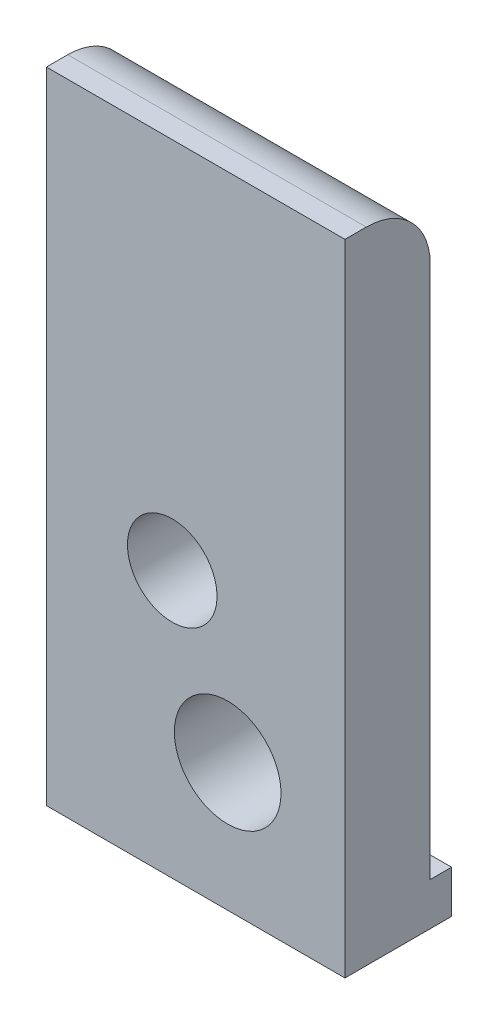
SolidWorks part; units mm, degrees
ref_plane "Plan1" through (0, 0, 0) normal (0, 0, 1) x (1, 0, 0)
ref_plane "Plan2" through (0, 0, 0) normal (0, 1, 0) x (1, 0, 0)
ref_plane "Plan3" through (0, 0, 0) normal (1, 0, 0) x (0, 0, -1)
sketch "Esquisse1" plane through (0, 0, 0) normal (0, 0, 1) x (1, 0, 0)
  line L0 (0, 0) -> (14, 0)
  line L1 (0, 0) -> (0, 30)
  line L2 (14, 30) -> (0, 30)
  line L3 (14, 30) -> (14, 0)
extrude "Base-Extrusion" add sketch "Esquisse1" along normal blind 5
sketch "Esquisse2" plane through (14, 0, 0) normal (1, 0, 0) x (0, 0, -1)
  line L0 (-8, 31) -> (-4, 31)
  line L1 (-8, 31) -> (-8, 2)
  line L2 (-4, 2) -> (-8, 2)
  line L3 (-4, 2) -> (-4, 31)
extrude "Enlèv. mat.-Extru.2" cut sketch "Esquisse2" against normal through all
fillet "Congé2" radius 3
sketch "Esquisse3" plane through (0, 30, 0) normal (0, 1, 0) x (-1, 0, 0)
  line L2 (-13.9, 0) -> (-13.1, 0)
  line L8 (-13.9, 0) -> (-13.5, 0.4)
  line L9 (-13.5, 0.4) -> (-13.1, 0)
extrude "Enlèv. mat.-Extru.3" cut sketch "Esquisse3" against normal blind 20
pattern_linear "Répétition linéaire1" count 14 spacing 1
sketch "Esquisse10" plane through (0, 0, 0) normal (-1, 0, 0) x (0, 0, 1)
  line L0 (4, 2) -> (6, 2)
  line L1 (4, 2) -> (4, -1)
  line L2 (6, -1) -> (4, -1)
  line L3 (6, -1) -> (6, 2)
  line L4 (4, 2) -> (4, 30) construction
extrude "Enlèv. mat.-Extru.17" cut sketch "Esquisse10" against normal blind 20
sketch "Esquisse11" plane through (0, 0, 0) normal (-1, 0, 0) x (0, 0, 1)
  line L0 (1, 2) -> (-1, 2)
  line L1 (1, 2) -> (1, 0)
  line L2 (-1, 0) -> (1, 0)
  line L3 (-1, 0) -> (-1, 2)
extrude "Boss.-Extru.2" add sketch "Esquisse11" against normal blind 14
sketch "Esquisse12" plane through (0, 0, 0) normal (0, 0, -1) x (-1, 0, 0)
  line L0 (-8.5, 6) -> (1.9673, 6) construction
  line L1 (-14, 0) -> (0, 0) construction
  line L2 (-14, 27) -> (-14, 2) construction
  circle A0 centre (-8.5, 6) radius 2.5
  dimension "D3" = 5
  dimension "D1" = 6
  dimension "D2" = 5.5
extrude "Enlèv. mat.-Extru.18" cut sketch "Esquisse12" against normal through all
sketch "Esquisse13" plane through (0, 0, 0) normal (0, 0, -1) x (-1, 0, 0)
  line L2 (-14, 0) -> (0, 0) construction
  line L4 (-14, 27) -> (-14, 2) construction
  circle A0 centre (-5.9, 12.5) radius 2.1
  dimension "D1" = 12.5
  dimension "D2" = 8.1
extrude "Enlèv. mat.-Extru.19" cut sketch "Esquisse13" against normal blind 14
